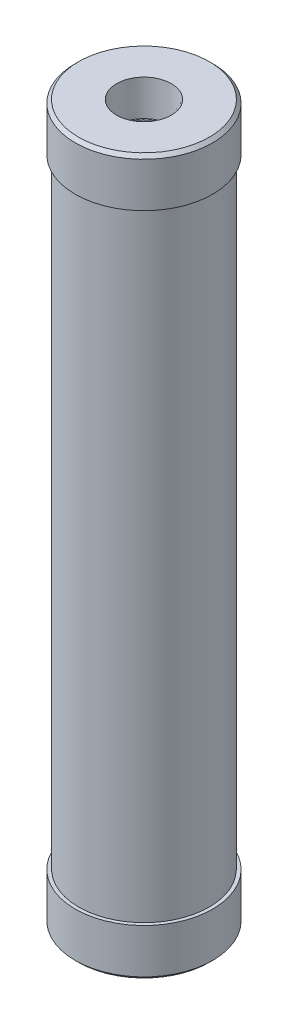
SolidWorks part; units mm, degrees
ref_plane "Front Plane" through (0, 0, 0) normal (0, 0, 1) x (1, 0, 0)
ref_plane "Top Plane" through (0, 0, 0) normal (0, 1, 0) x (1, 0, 0)
ref_plane "Right Plane" through (0, 0, 0) normal (1, 0, 0) x (0, 0, -1)
sketch "Sketch1" plane through (0, 0, 0) normal (0, 1, 0) x (1, 0, 0)
  circle A0 centre (0, 0) radius 30.1625
  circle A1 centre (0, 0) radius 25.9969
  dimension "D1" = 60.325
  dimension "D2" = 4.1656
extrude "Boss-Extrude1" add sketch "Sketch1" along normal blind 330.2
ref_plane "Plane1" through (0, 330.2, 0) normal (0, 1, 0) x (1, 0, 0)
sketch "Sketch2" plane through (0, 330.2, 0) normal (0, 1, 0) x (1, 0, 0)
  circle A0 centre (0, 0) radius 31.75
  dimension "D1" = 63.5
extrude "Boss-Extrude2" add sketch "Sketch2" against normal blind 22.098
hole_wizard "3/4 Rc Tapped Hole1" positions "Sketch4" profile "Sketch3" size "3/4" standard "BSI"
sketch "Sketch4" plane through (0, 330.2, 0) normal (0, 1, 0) x (1, 0, 0)
  point P0 (0, 0)
sketch "Sketch3" plane through (0, 330.2, 0) normal (1, 0, 0) x (0, 0, 1)
  line L0 (0, 0) -> (0, 32.3099)
  line L1 (11.5, 25.4) -> (0, 32.3099)
  line L2 (-11.5, 25.4) -> (0, 32.3099) construction
  line L3 (11.5, 25.4) -> (11.5, 16.256)
  line L4 (11.5, 16.256) -> (12.1307, 16.256)
  line L5 (12.1307, 16.256) -> (12.6381, 0)
  line L6 (-12.1307, 16.256) -> (-12.6381, 0) construction
  line L7 (12.6381, 0) -> (0, 0)
  line L8 (0, -6.35) -> (0, 107.95) construction
  line L11 (-11.5, 16.256) -> (-12.1307, 16.256) construction
  dimension "Tap Drill Dia." = 23
  dimension "Tap Drill Depth" = 25.4
  dimension "Thread Dia." = 25.2763
  dimension "Thread Angle" = 3.576
  dimension "Thread Depth" = 16.256
  dimension "Drill Angle" = 118
sketch "Sketch5" plane through (0, 0, 0) normal (0, 1, 0) x (1, 0, 0)
  circle A0 centre (0, 0) radius 31.75
  dimension "D1" = 63.5
extrude "Boss-Extrude3" add sketch "Sketch5" along normal blind 22.098
hole_wizard "3/4 Rc Tapped Hole2" positions "Sketch7" profile "Sketch6" size "3/4" standard "BSI"
sketch "Sketch7" plane through (0, 0, 0) normal (0, 1, 0) x (1, 0, 0)
  point P0 (0, 0)
sketch "Sketch6" plane through (0, 0, 0) normal (1, 0, 0) x (0, 0, -1)
  line L0 (0, 0) -> (0, 32.3099)
  line L1 (11.5, 25.4) -> (0, 32.3099)
  line L2 (-11.5, 25.4) -> (0, 32.3099) construction
  line L3 (11.5, 25.4) -> (11.5, 16.256)
  line L4 (11.5, 16.256) -> (12.1307, 16.256)
  line L5 (12.1307, 16.256) -> (12.6381, 0)
  line L6 (-12.1307, 16.256) -> (-12.6381, 0) construction
  line L7 (12.6381, 0) -> (0, 0)
  line L8 (0, -6.35) -> (0, 107.95) construction
  line L11 (-11.5, 16.256) -> (-12.1307, 16.256) construction
  dimension "Tap Drill Dia." = 23
  dimension "Tap Drill Depth" = 25.4
  dimension "Thread Dia." = 25.2763
  dimension "Thread Angle" = 3.576
  dimension "Thread Depth" = 16.256
  dimension "Drill Angle" = 118
chamfer "Chamfer1" distance 1.524 angle 45 2 edges at (0, 0, 31.75) (0, 330.2, 31.75)
